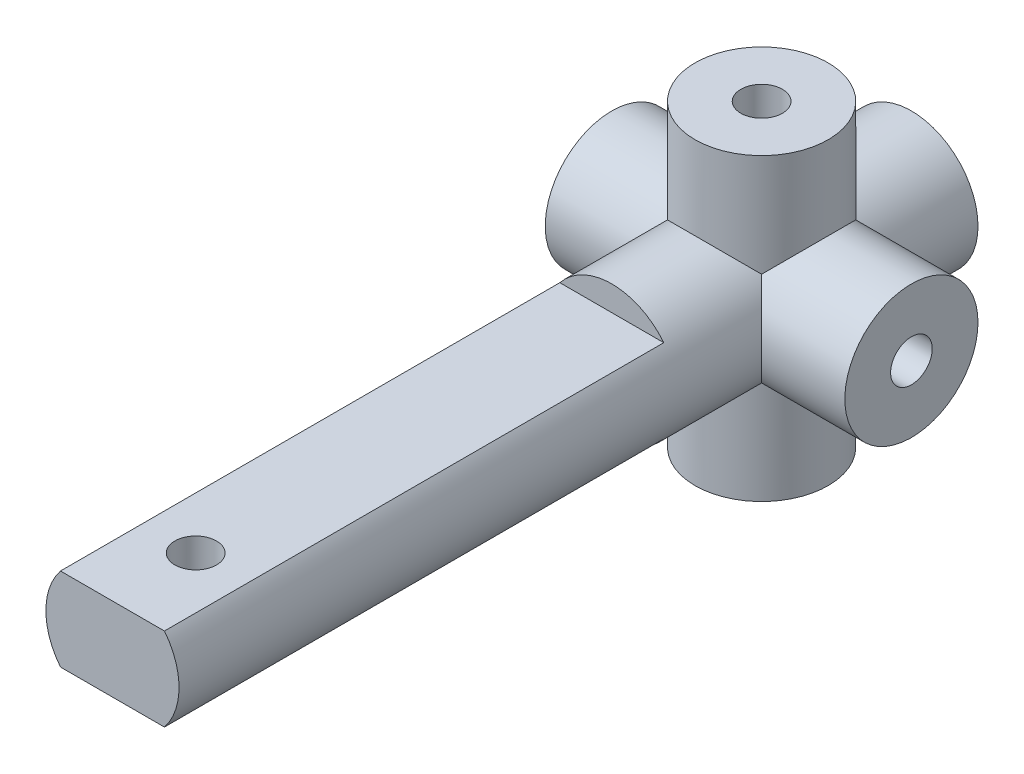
SolidWorks part; units mm, degrees
ref_plane "Front Plane" through (0, 0, 0) normal (0, 0, 1) x (1, 0, 0)
ref_plane "Top Plane" through (0, 0, 0) normal (0, 1, 0) x (1, 0, 0)
ref_plane "Right Plane" through (0, 0, 0) normal (1, 0, 0) x (0, 0, -1)
sketch "Sketch1" plane through (0, 0, 0) normal (0, 1, 0) x (1, 0, 0)
  circle A0 centre (0, 0) radius 4
  circle A1 centre (0, 0) radius 1.25
  dimension "D1" = 8
  dimension "D2" = 2.5
extrude "Boss-Extrude1" add sketch "Sketch1" along normal mid plane 18
sketch "Sketch2" plane through (0, 0, 0) normal (1, 0, 0) x (0, 0, -1)
  circle A0 centre (0, 0) radius 4
extrude "Boss-Extrude2" add sketch "Sketch2" along normal mid plane 18
sketch "Sketch5" plane through (0, 0, 0) normal (0, 0, 1) x (1, 0, 0)
  circle A0 centre (0, 0) radius 4
  dimension "D1" = 8
extrude "Boss-Extrude3" add sketch "Sketch5" along normal mid plane 18
sketch "Sketch6" plane through (-9, 0, 0) normal (-1, 0, 0) x (0, 0, 1)
  circle A0 centre (0, 0) radius 1.25
  dimension "D1" = 2.5
extrude "Cut-Extrude1" cut sketch "Sketch6" against normal blind 18
sketch "Sketch7" plane through (0, 0, 9) normal (0, 0, 1) x (1, 0, 0)
  circle A0 centre (0, 0) radius 1.25
  dimension "D1" = 2.5
extrude "Cut-Extrude2" cut sketch "Sketch7" against normal blind 18
sketch "Sketch8" plane through (0, -9, 0) normal (0, -1, 0) x (1, 0, 0)
  circle A1 centre (0, 0) radius 1.25
extrude "Cut-Extrude3" cut sketch "Sketch8" against normal blind 21
sketch "Sketch9" plane through (0, 0, 9) normal (0, 0, 1) x (1, 0, 0)
  circle A0 centre (0, 0) radius 4
extrude "Boss-Extrude4" add sketch "Sketch9" along normal blind 30
sketch "Sketch10" plane through (0, -9, 0) normal (0, -1, 0) x (1, 0, 0)
  circle A0 centre (0, 34.0006) radius 1.25
  dimension "D1" = 2.5
extrude "Cut-Extrude4" cut sketch "Sketch10" against normal blind 30
sketch "Sketch11" plane through (0, 0, 39) normal (0, 0, 1) x (1, 0, 0)
  line L1 (-6.3071, 2.5) -> (6.3071, 2.5)
  line L2 (-6.3071, 2.5) -> (-6.3071, -2.5)
  line L3 (-6.3071, -2.5) -> (6.3071, -2.5)
  line L4 (6.3071, 2.5) -> (6.3071, -2.5)
  line L5 (-6.3071, 2.5) -> (6.3071, -2.5) construction
  line L6 (-6.3071, -2.5) -> (6.3071, 2.5) construction
  point P0 (0, 0)
  dimension "D1" = 5
extrude "Cut-Extrude5" cut sketch "Sketch11" against normal blind 30 contours L3 M2 | L1 M2
